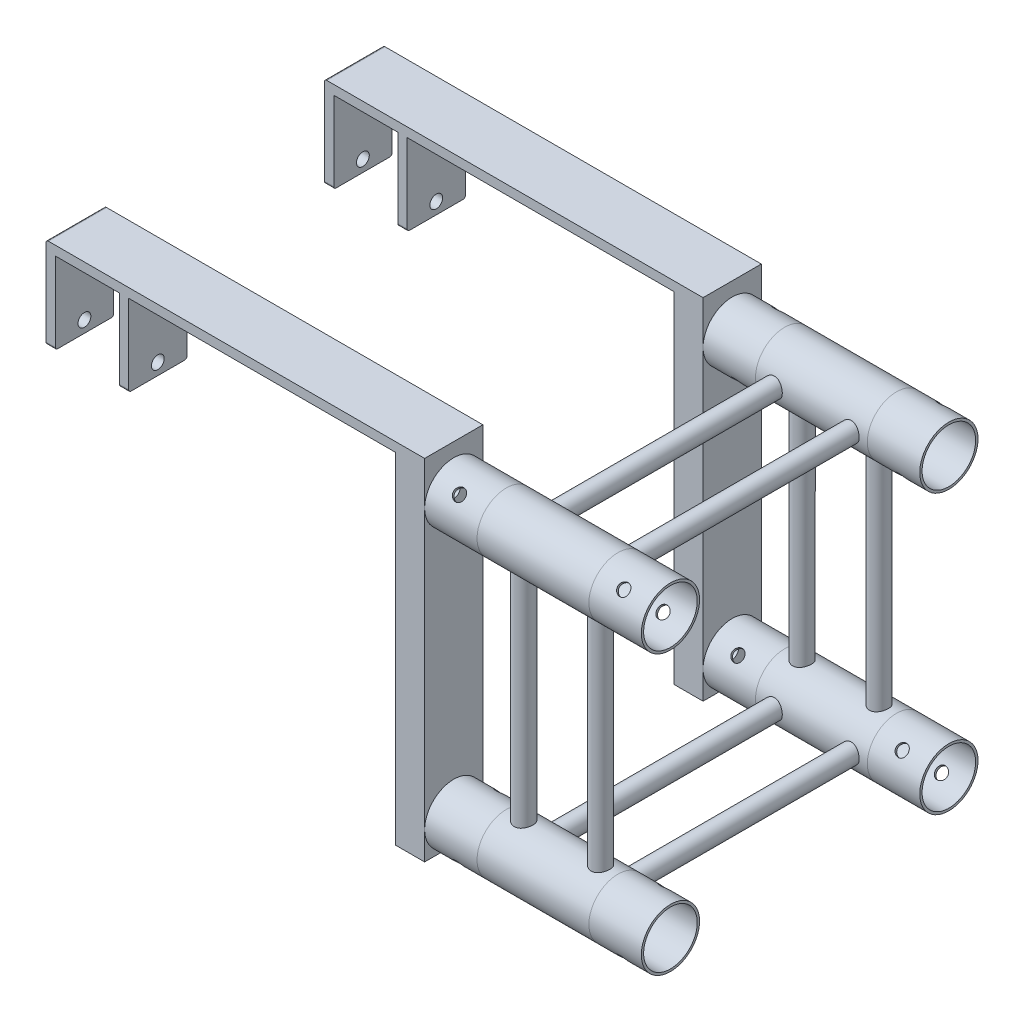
SolidWorks part; units mm, degrees
ref_plane "Face" through (0, 0, 0) normal (0, 0, 1) x (1, 0, 0)
ref_plane "Dessus" through (0, 0, 0) normal (0, 1, 0) x (1, 0, 0)
ref_plane "Droite" through (0, 0, 0) normal (1, 0, 0) x (0, 0, -1)
sketch "Esquisse1" plane through (0, 0, 0) normal (0, 0, 1) x (1, 0, 0)
  line L0 (0, 0) -> (0, 78)
  line L1 (0, 78) -> (325, 78)
  line L2 (325, 78) -> (325, 70)
  line L3 (325, 70) -> (71, 70)
  line L4 (71, 70) -> (71, 0)
  line L5 (71, 0) -> (63, 0)
  line L6 (63, 0) -> (63, 70)
  line L7 (63, 70) -> (8, 70)
  line L8 (8, 70) -> (8, 0)
  line L9 (8, 0) -> (0, 0)
  dimension "D1" = 325
  dimension "D2" = 254
  dimension "D3" = 8
  dimension "D4" = 8
  dimension "D5" = 78
  dimension "D6" = 8
extrude "Extrusion1" add sketch "Esquisse1" along normal blind 50
sketch "Esquisse2" plane through (0, 70, 0) normal (0, -1, 0) x (1, 0, 0)
  line L0 (300, 50) -> (325, 50)
  line L1 (71, 50) -> (325, 50) construction
  line L2 (325, 50) -> (325, 0)
  line L3 (325, 0) -> (300, 0)
  line L4 (71, 0) -> (325, 0) construction
  line L5 (300, 0) -> (300, 5)
  line L6 (300, 5) -> (320, 5)
  line L7 (320, 5) -> (320, 45)
  line L8 (320, 45) -> (300, 45)
  line L9 (300, 45) -> (300, 50)
  dimension "D1" = 25
  dimension "D2" = 5
  dimension "D3" = 5
extrude "Extrusion2" add sketch "Esquisse2" along normal blind 292
sketch "Esquisse3" plane through (325, 0, 0) normal (1, 0, 0) x (0, 0, -1)
  line L0 (0, -222) -> (0, 78) construction
  line L1 (0, -222) -> (-50, -222) construction
  circle A0 centre (-25, 41) radius 5.5
  circle A1 centre (-25, -198) radius 5.5
  dimension "D1" = 11
  dimension "D2" = 25
  dimension "D3" = 239
  dimension "D4" = 24
extrude "Enlèv. mat.-Extru.1" cut sketch "Esquisse3" against normal up to next
sketch "Esquisse4" plane through (71, 0, 0) normal (1, 0, 0) x (0, 0, -1)
  line L0 (0, -222) -> (0, 78) construction
  line L1 (-50, 0) -> (0, 0) construction
  circle A0 centre (-25, 10) radius 5.5
  dimension "D2" = 11
  dimension "D1" = 25
  dimension "D3" = 10
extrude "Enlèv. mat.-Extru.2" cut sketch "Esquisse4" against normal through all
fillet "Congé1" radius 2
sketch "Esquisse5" plane through (325, 0, 0) normal (1, 0, 0) x (0, 0, -1)
  circle A0 centre (-25, 41) radius 25
  circle A1 centre (-25, -198) radius 25
  circle A2 centre (-25, 41) radius 5.5 construction
  circle A3 centre (-25, -198) radius 5.5 construction
  dimension "D1" = 50
extrude "Extru.-Mince1" add sketch "Esquisse5" along normal blind 186 thin
sketch "Esquisse6" plane through (0, 0, 0) normal (0, 0, 1) x (1, 0, 0)
  line L0 (370, 95.5318) -> (370, -246.8713)
  line L1 (325, -198) -> (325, 41) construction
  line L2 (466, 95.5318) -> (466, -246.8713)
  line L3 (511, 16) -> (511, 66) construction
  line L4 (466, 95.5318) -> (370, 95.5318)
  line L5 (466, -246.8713) -> (370, -246.8713)
  dimension "D1" = 45
  dimension "D2" = 45
ref_plane "Plan3" through (0, 0, 25) normal (0, 0, 1) x (1, 0, 0)
pattern_linear "Répétition linéaire1" count 2 spacing 239
ref_plane "Plan6" through (385, 0, 0) normal (1, 0, 0) x (0, 0, -1)
sketch "Esquisse11" plane through (385, 0, 0) normal (1, 0, 0) x (0, 0, -1)
  line L0 (-25, 41) -> (-264, 41)
  line L1 (-264, 41) -> (-264, -198)
  line L2 (-25, -198) -> (-264, -198)
  line L3 (-25, -198) -> (-25, 41)
ref_plane "Plan7" through (385, -198, 264) normal (0, 0, 1) x (1, 0, 0)
sketch "Esquisse12" plane through (385, -198, 264) normal (0, 0, 1) x (1, 0, 0)
  circle A0 centre (0, 0) radius 8
  dimension "D1" = 16
sweep "Balayage-Mince3" add profiles "Esquisse12" path "Esquisse11" parameters "D1"=2
pattern_linear "Répétition linéaire3" count 2 spacing 66
ref_plane "Plan8" through (0, 152.5, 152.5) normal (0, 0.7071, 0.7071) x (-1, 0, 0)
sketch "Esquisse13" plane through (0, 152.5, 152.5) normal (0, 0.7071, 0.7071) x (-1, 0, 0)
  line L0 (-466, 157.6848) -> (-370, 157.6848) construction
  line L1 (-511, 182.6848) -> (-511, 132.6848) construction
  line L2 (-370, 132.6848) -> (-370, 182.6848) construction
  circle A0 centre (-488.5, 157.6848) radius 5
  circle A1 centre (-347.5, 157.6848) radius 5
  dimension "D1" = 10
  dimension "D2" = 22.5
  dimension "D3" = 22.5
extrude "Enlèv. mat.-Extru.3" cut sketch "Esquisse13" against normal through all and the other way through all
ref_plane "Plan9" through (0, 8, -8) normal (0, 0.7071, -0.7071) x (-1, 0, 0)
sketch "Esquisse14" plane through (0, 8, -8) normal (0, 0.7071, -0.7071) x (-1, 0, 0)
  line L0 (-466, 46.669) -> (-370, 46.669) construction
  line L1 (-511, 71.669) -> (-511, 21.669) construction
  line L2 (-370, 71.669) -> (-370, 21.669) construction
  circle A0 centre (-347.5, 46.669) radius 5
  circle A1 centre (-488.5, 46.669) radius 5
  dimension "D1" = 10
  dimension "D3" = 22.5
  dimension "D2" = 22.5
extrude "Enlèv. mat.-Extru.4" cut sketch "Esquisse14" against normal through all and the other way through all
